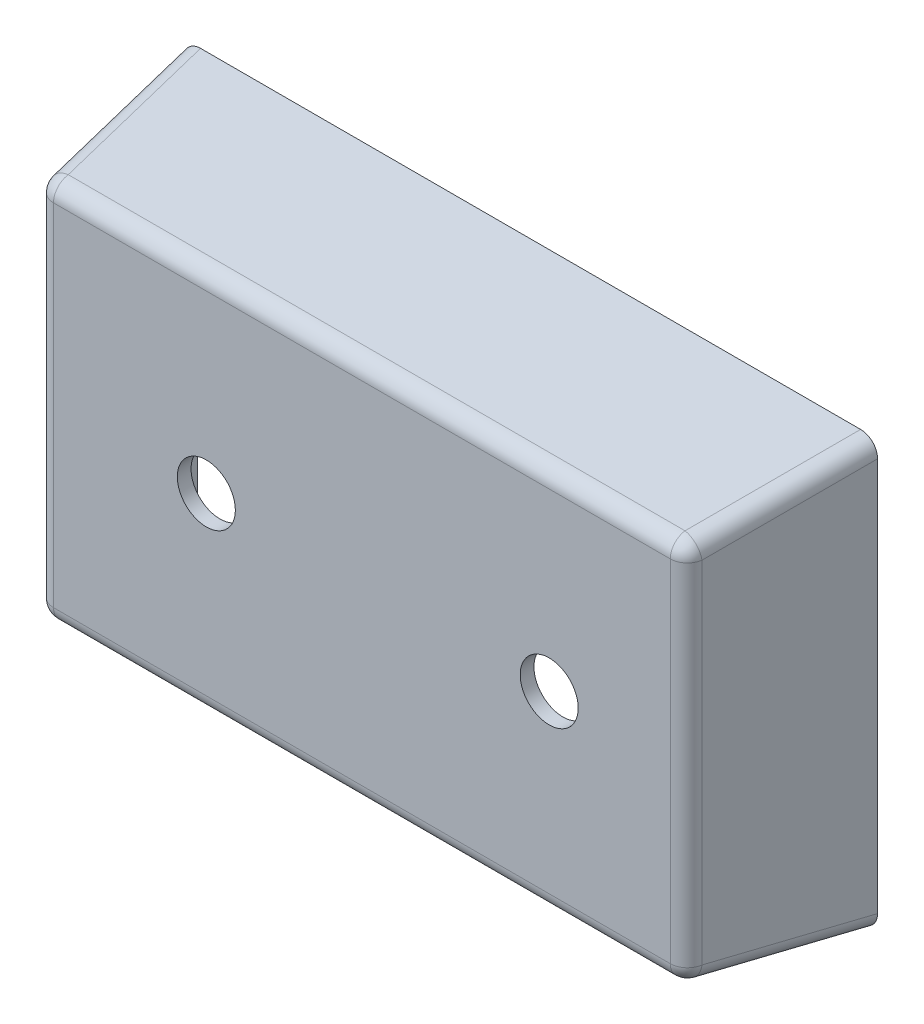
SolidWorks part; units mm, degrees
ref_plane "Front Plane" through (0, 0, 0) normal (0, 0, 1) x (1, 0, 0)
ref_plane "Top Plane" through (0, 0, 0) normal (0, 1, 0) x (1, 0, 0)
ref_plane "Right Plane" through (0, 0, 0) normal (1, 0, 0) x (0, 0, -1)
sketch "Sketch1"
extrude "Extrude1" add sketch "Sketch1" along normal blind 31.242 draft 8
fillet "Fillet1" radius 3.175 8 edges at (-2.9434, 35.2224, 31.242) (56.9299, 0, 31.242) (-2.9434, -35.2224, 31.242) (-62.8167, 0, 31.242) (59.1253, -37.4178, 15.621) (59.1253, 37.4178, 15.621) (-65.0121, -37.4178, 15.621) (-65.0121, 37.4178, 15.621)
shell "Shell1" thickness 2.54
sketch "Sketch4"
  dimension "D1" = 63.5
extrude "Extrude2" cut sketch "Sketch4" against normal through all
